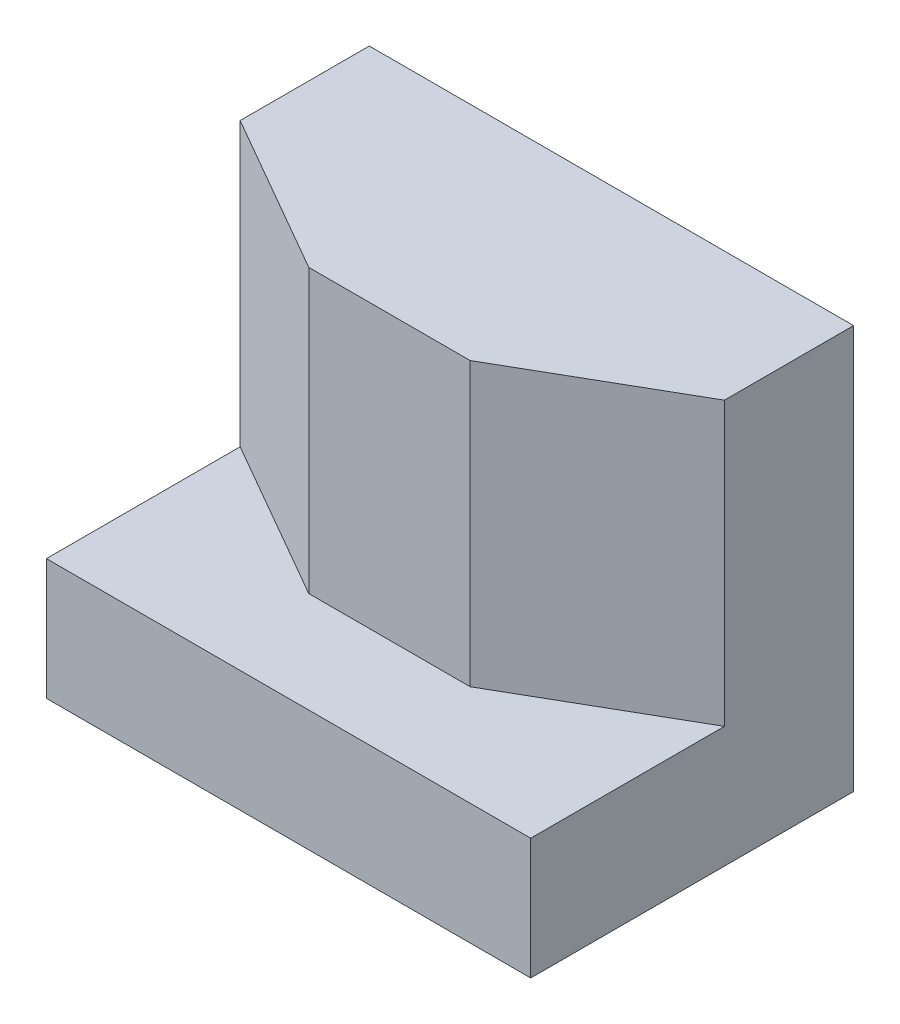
SolidWorks part; units mm, degrees
ref_plane "前视基准面" through (0, 0, 0) normal (0, 0, 1) x (1, 0, 0)
ref_plane "上视基准面" through (0, 0, 0) normal (0, 1, 0) x (1, 0, 0)
ref_plane "右视基准面" through (0, 0, 0) normal (1, 0, 0) x (0, 0, -1)
sketch "草图1" plane through (0, 0, 0) normal (0, 1, 0) x (1, 0, 0)
  line L0 (-82.696, 0) -> (107.9865, 0) construction
  line L1 (0, -85.506) -> (0, 103.1693) construction
  line L3 (-60, 40) -> (60, 40)
  line L4 (-60, 40) -> (-60, -40)
  line L5 (-60, -40) -> (60, -40)
  line L6 (60, 40) -> (60, -40)
  dimension "D1" = 120
  dimension "D2" = 80
extrude "拉伸1" add sketch "草图1" along normal blind 100
sketch "草图2" plane through (0, 100, 0) normal (0, 1, 0) x (1, 0, 0)
  line L0 (-60, 8) -> (-20, -15)
  line L1 (-60, 40) -> (-60, -40) construction
  line L2 (-20, -15) -> (20, -15)
  line L3 (20, -15) -> (60, 8)
  line L4 (60, -40) -> (60, 40) construction
  line L5 (60, 8) -> (60, -40)
  line L6 (60, -40) -> (-60, -40)
  line L7 (-60, -40) -> (-60, 8)
  line L8 (0, -51.1494) -> (0, 47.5096) construction
  dimension "D1" = 40
  dimension "D2" = 25
  dimension "D3" = 48
extrude "切除-拉伸1" cut sketch "草图2" against normal blind 70
